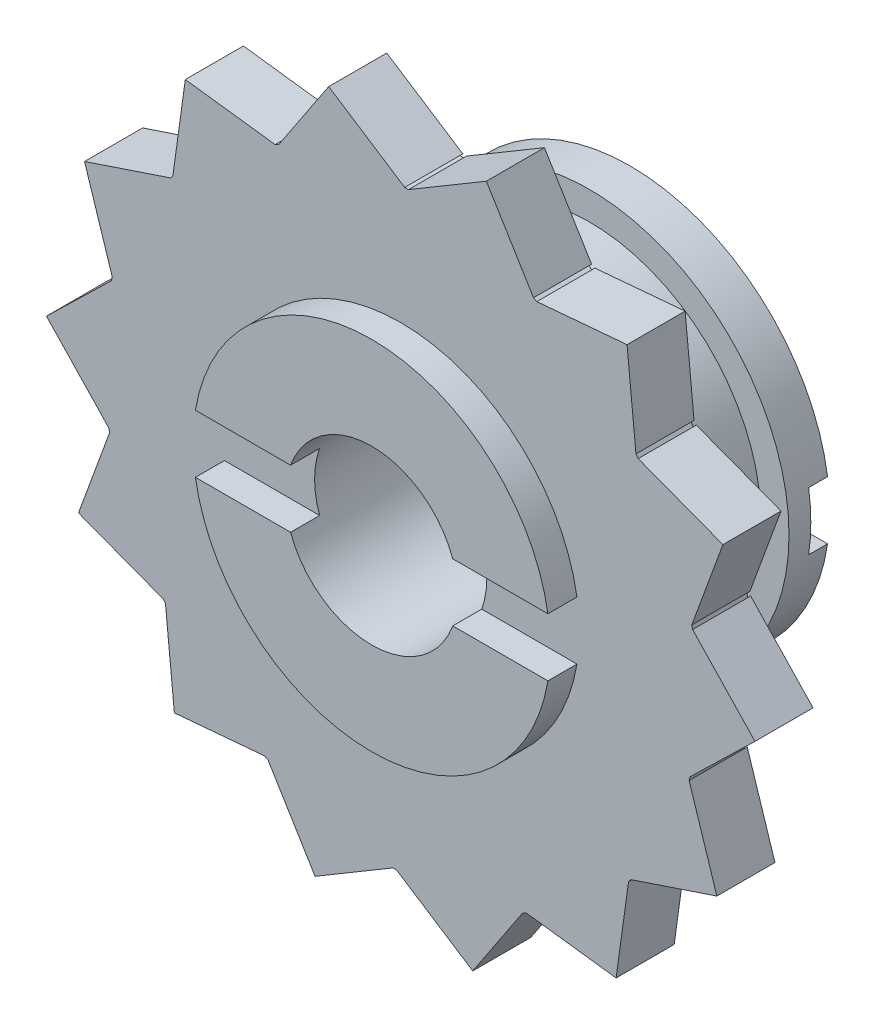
SolidWorks part; units mm, degrees
ref_plane "Plan de face" through (0, 0, 0) normal (0, 0, 1) x (1, 0, 0)
ref_plane "Plan de dessus" through (0, 0, 0) normal (0, 1, 0) x (1, 0, 0)
ref_plane "Plan de droite" through (0, 0, 0) normal (1, 0, 0) x (0, 0, -1)
sketch "Esquisse1" plane through (0, 0, 0) normal (0, 0, 1) x (1, 0, 0)
  circle A0 centre (0, 0) radius 10.25
  dimension "D1" = 20.5
extrude "Extrusion1" add sketch "Esquisse1" along normal blind 8.9
sketch "Esquisse2" plane through (0, 0, 8.9) normal (0, 0, 1) x (1, 0, 0)
  line L0 (-9.3397, 0) -> (9.3791, 0) construction
  line L1 (9.3791, 2.4433) -> (9.3791, -3.0738) construction
  line L2 (-9.3397, 2.995) -> (-9.3397, -2.5615) construction
  line L3 (-6.15, 0) -> (-6.15, 2.995) construction
  line L4 (6.15, 0) -> (6.15, 2) construction
  line L5 (-6.15, 1) -> (6.15, 1)
  line L6 (-6.15, -1) -> (6.15, -1)
  circle A0 centre (0, 0) radius 6.15
  circle A1 centre (0, 0) radius 2.96
  dimension "D1" = 12.3
  dimension "D2" = 5.92
  dimension "D3" = 1
extrude "Enlèv. mat.-Extru.2" cut sketch "Esquisse2" against normal blind 1
sketch "Esquisse4" plane through (0, 0, 7.9) normal (0, 0, 1) x (1, 0, 0)
  circle A0 centre (0, 0) radius 12.2
  dimension "D1" = 24.4
extrude "Extrusion2" add sketch "Esquisse4" against normal blind 2
sketch "Esquisse3" plane through (0, 0, 8.9) normal (0, 0, 1) x (1, 0, 0)
  circle A0 centre (0, 0) radius 2.965
  dimension "D1" = 5.93
extrude "Enlèv. mat.-Extru.3" cut sketch "Esquisse3" against normal through all
sketch "Esquisse6" plane through (0, 0, 5.9) normal (0, 0, -1) x (-1, 0, 0)
  line L0 (-2.9491, 11.8382) -> (0, 0) construction
  line L1 (-0.2409, 12.1976) -> (0, 0) construction
  line L2 (0, 0) -> (2.4793, 11.9454) construction
  line L3 (4.613, 22.2254) -> (-0.437, 22.1257) construction
  line L4 (-0.437, 22.1257) -> (-5.4871, 22.0259) construction
  line L5 (-0.2409, 12.1976) -> (0, 0)
  line L6 (2.4793, 11.9454) -> (-0.2016, 10.208)
  line L7 (-0.2016, 10.208) -> (-2.9491, 11.8382)
  line L8 (-4.6108, 9.1096) -> (-2.9491, 11.8382)
  line L9 (-7.7935, 9.3863) -> (-4.6108, 9.1096)
  line L10 (0, 0) -> (-7.7935, 9.3863) construction
  line L11 (-8.1067, 6.2069) -> (-11.0942, 5.0753)
  line L12 (-7.7935, 9.3863) -> (-8.1067, 6.2069)
  line L13 (4.2474, 9.2846) -> (7.4167, 9.6867)
  line L14 (2.4793, 11.9454) -> (4.2474, 9.2846)
  line L15 (-11.0942, 5.0753) -> (0, 0) construction
  line L16 (0, 0) -> (7.4167, 9.6867) construction
  line L17 (-9.9969, 2.0749) -> (-11.0942, 5.0753)
  line L18 (-12.1976, -0.2409) -> (-9.9969, 2.0749)
  line L19 (10.8851, 5.5094) -> (7.8552, 6.5222)
  line L20 (7.8552, 6.5222) -> (7.4167, 9.6867)
  line L21 (10.8851, 5.5094) -> (0, 0) construction
  line L22 (9.9072, 2.4681) -> (12.1976, 0.2409)
  line L23 (10.8851, 5.5094) -> (9.9072, 2.4681)
  line L24 (12.1976, 0.2409) -> (-12.1976, -0.2409) construction
  line L25 (9.9969, -2.0749) -> (12.1976, 0.2409)
  line L26 (11.0942, -5.0753) -> (9.9969, -2.0749)
  line L27 (11.0942, -5.0753) -> (8.1067, -6.2069)
  line L28 (8.1067, -6.2069) -> (7.7935, -9.3863)
  line L29 (4.6108, -9.1096) -> (7.7935, -9.3863)
  line L30 (2.9491, -11.8382) -> (0.2016, -10.208)
  line L31 (2.9491, -11.8382) -> (4.6108, -9.1096)
  line L32 (-12.1976, -0.2409) -> (-9.9072, -2.4681)
  line L33 (-9.9072, -2.4681) -> (-10.8851, -5.5094)
  line L34 (-7.8552, -6.5222) -> (-10.8851, -5.5094)
  line L35 (-7.4167, -9.6867) -> (-4.2474, -9.2846)
  line L36 (-7.4167, -9.6867) -> (-7.8552, -6.5222)
  line L37 (-4.2474, -9.2846) -> (-2.4793, -11.9454)
  line L38 (0.2016, -10.208) -> (-2.4793, -11.9454)
  circle A0 centre (0, 0) radius 12.2
  arc A1 (-2.9491, 11.8382) -> (-7.7935, 9.3863) centre (-4.6108, 9.1096) ccw
  circle A2 centre (0, 0) radius 10.21
  arc A3 (2.4793, 11.9454) -> (-2.9491, 11.8382) centre (-0.2016, 10.208) ccw
  circle A4 centre (0, 0) radius 12.2 construction
  arc A5 (-7.7935, 9.3863) -> (-11.0942, 5.0753) centre (-8.1067, 6.2069) ccw
  arc A6 (-11.0942, 5.0753) -> (-12.1976, -0.2409) centre (-9.9969, 2.0749) ccw
  arc A7 (12.1976, 0.2409) -> (10.8851, 5.5094) centre (9.9072, 2.4681) ccw
  arc A8 (10.8851, 5.5094) -> (7.4167, 9.6867) centre (7.8552, 6.5222) ccw
  arc A9 (7.4167, 9.6867) -> (2.4793, 11.9454) centre (4.2474, 9.2846) ccw
  arc A10 (12.1976, 0.2409) -> (11.0942, -5.0753) centre (9.9969, -2.0749) cw
  arc A11 (11.0942, -5.0753) -> (7.7935, -9.3863) centre (8.1067, -6.2069) cw
  arc A12 (2.9491, -11.8382) -> (-2.4793, -11.9454) centre (0.2016, -10.208) cw
  arc A13 (-2.4793, -11.9454) -> (-7.4167, -9.6867) centre (-4.2474, -9.2846) cw
  arc A14 (-7.4167, -9.6867) -> (-10.8851, -5.5094) centre (-7.8552, -6.5222) cw
  arc A15 (-10.8851, -5.5094) -> (-12.1976, -0.2409) centre (-9.9072, -2.4681) cw
  arc A16 (7.7935, -9.3863) -> (2.9491, -11.8382) centre (4.6108, -9.1096) cw
  dimension "D1" = 20.42
  dimension "D4" = 24.4
  dimension "D2" = 25.714
  dimension "D3" = 12.1976
extrude "Enlèv. mat.-Extru.4" cut sketch "Esquisse6" against normal blind 10
sketch "Esquisse7" plane through (0, 0, 0) normal (0, 0, -1) x (-1, 0, 0)
  circle A0 centre (0, 0) radius 6.87
  circle A1 centre (0, 0) radius 10.25
  dimension "D1" = 13.74
  dimension "D2" = 20.5
extrude "Enlèv. mat.-Extru.5" cut sketch "Esquisse7" against normal blind 1.4
sketch "Esquisse8" plane through (0, 0, 1.4) normal (0, 0, -1) x (-1, 0, 0)
  circle A0 centre (0, 0) radius 5.9
  circle A1 centre (0, 0) radius 10.25
  dimension "D1" = 11.8
  dimension "D2" = 20.5
extrude "Enlèv. mat.-Extru.7" cut sketch "Esquisse8" against normal blind 3.15
sketch "Esquisse9" plane through (0, 0, 4.55) normal (0, 0, -1) x (-1, 0, 0)
  circle A0 centre (0, 0) radius 6.95
  circle A1 centre (0, 0) radius 10.25
  dimension "D1" = 13.9
  dimension "D2" = 20.5
extrude "Enlèv. mat.-Extru.8" cut sketch "Esquisse9" against normal blind 1.45
sketch "Esquisse10" plane through (0, 0, 0) normal (0, 0, -1) x (-1, 0, 0)
  line L0 (-6.87, 0) -> (6.87, 0) construction
  line L2 (-6.87, 0) -> (6.7968, 0)
  line L3 (-6.87, 0) -> (-6.87, 1)
  line L4 (-6.87, 1) -> (6.7968, 1)
  line L5 (6.7968, 0) -> (6.7968, 1)
  line L6 (-6.87, 0) -> (6.7968, 0)
  line L7 (-6.87, 0) -> (-6.87, -1)
  line L8 (-6.87, -1) -> (6.7968, -1)
  line L9 (6.7968, 0) -> (6.7968, -1)
  circle A0 centre (0, 0) radius 6.87 construction
  circle A1 centre (0, 0) radius 2.965
  dimension "D3" = 5.93
  dimension "D1" = 1
  dimension "D2" = 1
extrude "Enlèv. mat.-Extru.10" cut sketch "Esquisse10" against normal blind 0.65
sketch "Esquisse12" plane through (0, 0, 0) normal (1, 0, 0) x (0, 0, -1)
  line L0 (-2.975, -5.9) -> (-2.975, 5.9)
  line L1 (-1.4, -5.9) -> (-4.55, -5.9)
  line L2 (-1.4, -5.9) -> (-1.4, 5.9)
  line L3 (-1.4, 5.9) -> (-4.55, 5.9)
  line L4 (-4.55, -5.9) -> (-4.55, 5.9)
  line L5 (-1.4, 0) -> (-4.55, 0)
  circle A0 centre (-2.975, 0) radius 1.15
  dimension "D1" = 2.3
extrude "Enlèv. mat.-Extru.11" cut sketch "Esquisse12" against normal through all and the other way through all
